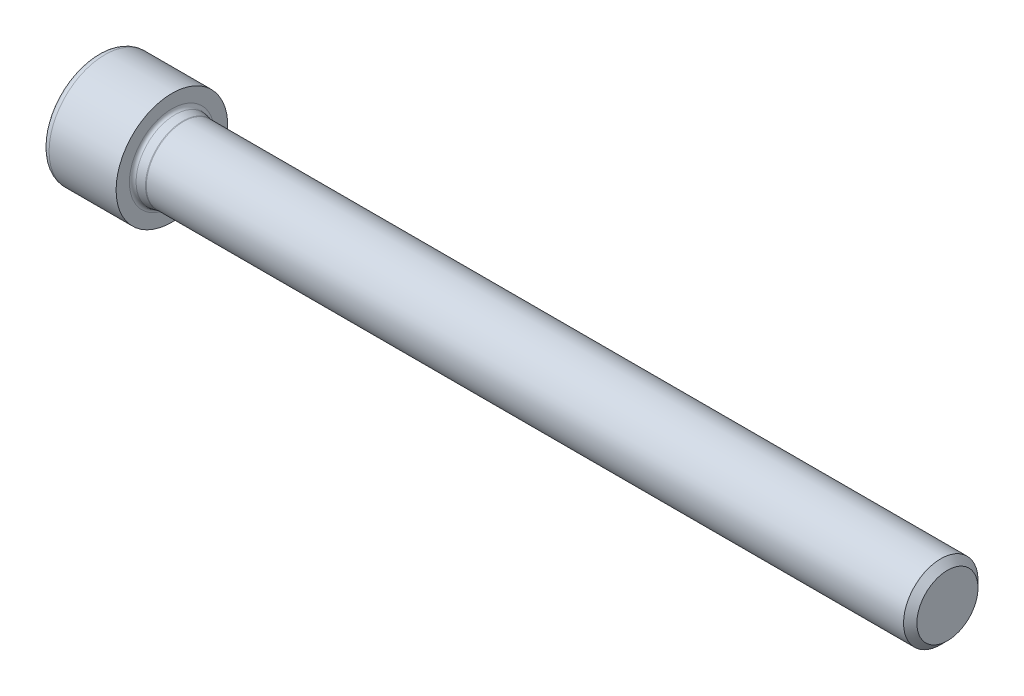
SolidWorks part; units mm, degrees
ref_plane "Ebene vorne" through (0, 0, 0) normal (0, 0, 1) x (1, 0, 0)
ref_plane "Ebene oben" through (0, 0, 0) normal (0, 1, 0) x (1, 0, 0)
ref_plane "Ebene rechts" through (0, 0, 0) normal (1, 0, 0) x (0, 0, -1)
ref_plane "Ebene1" through (0, 0, 0) normal (0, 1, 0) x (-1, 0, 0)
sketch "Skizze1" plane through (0, 0, 0) normal (0, 1, 0) x (-1, 0, 0)
  line L0 (1.9132, 0) -> (4.8, -5)
  line L1 (4.8, -5) -> (11.285, -5)
  line L2 (11.285, -5) -> (12, -5.715)
  line L3 (12, -5.715) -> (12, -7.8)
  line L4 (10.8, -9) -> (0, -9)
  line L5 (0, -9) -> (0, -6.85)
  line L6 (-0.4841, -6.2613) -> (-1.7541, -6.0113)
  line L7 (-1.87, -6) -> (-123.9265, -6)
  line L8 (-123.9265, -6) -> (-125, -4.9265)
  line L9 (-125, -4.9265) -> (-125, 0)
  line L10 (-125, 0) -> (1.9132, 0)
  line L11 (-125, 0) -> (12, 0) construction
  arc A0 (12, -7.8) -> (10.8, -9) centre (10.8, -7.8) cw
  arc A1 (0, -6.85) -> (-0.4841, -6.2613) centre (-0.6, -6.85) ccw
  arc A2 (-1.7541, -6.0113) -> (-1.87, -6) centre (-1.87, -6.6) ccw
revolve "Rotation1" add sketch "Skizze1" angle 360 about L11
ref_plane "Ebene2" through (-4.8, 0, 0) normal (1, 0, 0) x (0, 0, -1)
sketch "Skizze2" plane through (-4.8, 0, 0) normal (1, 0, 0) x (0, 0, -1)
  line L0 (-5, 2.8868) -> (-5, -2.8868)
  line L1 (-5, -2.8868) -> (0, -5.7735)
  line L2 (0, -5.7735) -> (5, -2.8868)
  line L3 (5, -2.8868) -> (5, 2.8868)
  line L4 (5, 2.8868) -> (0, 5.7735)
  line L5 (0, 5.7735) -> (-5, 2.8868)
extrude "Schnitt-Linear austragen1" cut sketch "Skizze2" against normal blind 12
